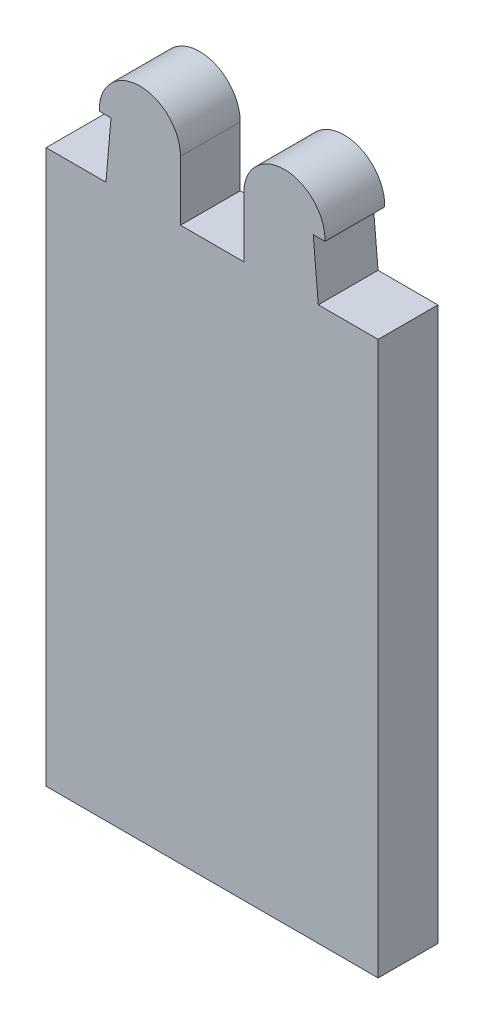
SolidWorks part; units mm, degrees
ref_plane "Front Plane" through (0, 0, 0) normal (0, 0, 1) x (1, 0, 0)
ref_plane "Top Plane" through (0, 0, 0) normal (0, 1, 0) x (1, 0, 0)
ref_plane "Right Plane" through (0, 0, 0) normal (1, 0, 0) x (0, 0, -1)
sketch "Sketch1" plane through (0, 0, 0) normal (0, 0, 1) x (1, 0, 0)
  line L0 (1.5, 12.5) -> (1.5, 15.2) construction
  line L1 (7.5053, -12.5) -> (-7.5053, -12.5)
  line L2 (7.5053, -12.5) -> (7.5053, 12.5)
  line L3 (7.5053, 12.5) -> (4.8001, 12.5)
  line L4 (-7.5053, -12.5) -> (-7.5053, 12.5)
  line L5 (7.5053, -12.5) -> (-7.5053, 12.5) construction
  line L6 (7.5053, 12.5) -> (-7.5053, -12.5) construction
  line L7 (4.5, 12.5) -> (4.5, 15.2) construction
  line L8 (4.5, 15.2) -> (5.0297, 15.2) construction
  line L9 (0, 0) -> (0, 30.8513) construction
  line L10 (5.0297, 15.2) -> (5.0297, 12.5) construction
  line L11 (1.43, 12.5) -> (1.43, 15.2)
  line L12 (4.57, 15.13) -> (5.0984, 15.13)
  line L14 (1.43, 12.5) -> (1.43, 15.2) construction
  line L16 (-4.57, 15.13) -> (-5.0984, 15.13)
  line L17 (-1.43, 12.5) -> (-1.43, 15.2)
  line L18 (-1.43, 12.5) -> (-4.57, 12.5) construction
  line L19 (-4.8001, 12.5) -> (-7.5053, 12.5)
  line L20 (4.5, 12.5) -> (1.5, 12.5) construction
  line L21 (1.43, 12.5) -> (-1.43, 12.5)
  line L22 (1.5, 12.5) -> (1.43, 12.5) construction
  line L23 (4.57, 12.5) -> (4.5, 12.5) construction
  line L33 (4.8001, 12.5) -> (4.57, 15.13)
  line L34 (-4.8001, 12.5) -> (-4.57, 15.13)
  line L35 (4.57, 12.5) -> (4.57, 15.13) construction
  arc A0 (5.0297, 15.2) -> (1.5, 15.2) centre (3.2649, 15.2) ccw construction
  arc A1 (5.0984, 15.13) -> (1.43, 15.2) centre (3.2649, 15.2) ccw
  arc A2 (-5.0984, 15.13) -> (-1.43, 15.2) centre (-3.2649, 15.2) cw
  point P0 (0, 0)
extrude "Boss-Extrude1" add sketch "Sketch1" along normal blind 2.7
equation "\"Thick\"= 2.7"
equation "\"h\"= 3"
equation "\"kerf\"= .14"
equation "\"Length\"= \"Thick\""
equation "\"D4@Sketch1\"= \"h\""
equation "\"D5@Sketch1\" = \"h\""
equation "\"Deflection\"= .4 * \"Thick\""
equation "\"D8@Sketch1\"=\"kerf\"/2"
equation "\"D1@Boss-Extrude1\"=\"Thick\""
equation "\"Strain\"= \"Deflection\" / \"Length\""
equation "\"D3@Sketch1\"=\"Length\""
equation "\"Per_def\"= 1.09 * ( \"Strain\" * \"Length\" * \"Length\" ) / \"h\""
equation "\"D6@Sketch1\" = \"h\" * .5"
equation "\"D2@Sketch1\"= \"Per_def\" / 2"
equation "\"ancho_total\"= 30 + \"kerf\" / 2"
equation "\"angulo_nuevo\"=95"
equation "\"D10@Sketch1\"=\"angulo_nuevo\""
